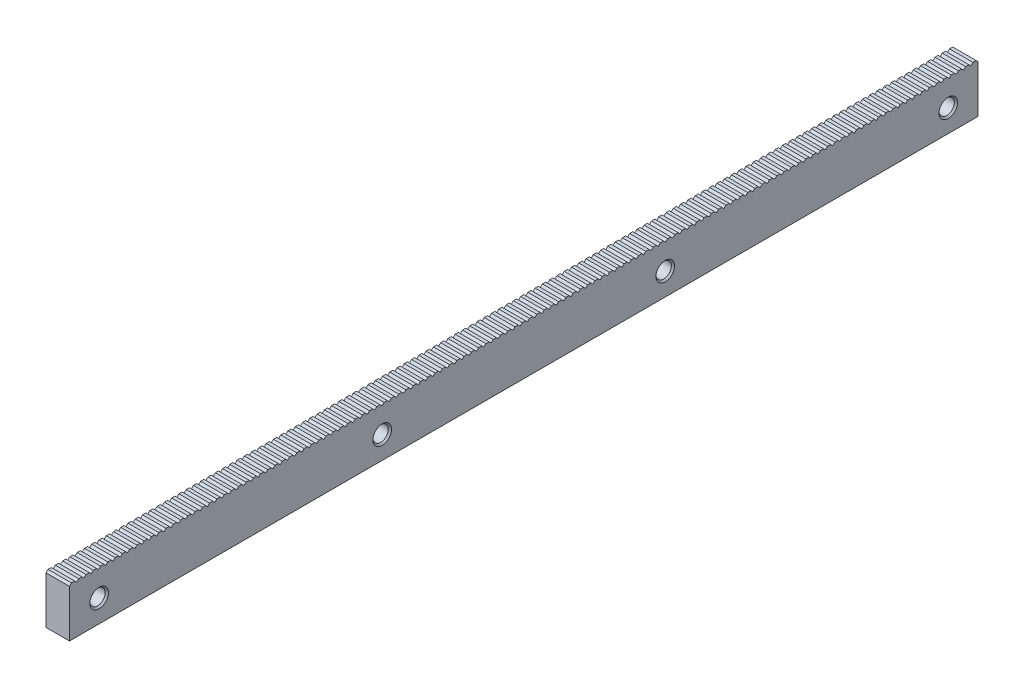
SolidWorks part; units mm, degrees
ref_plane "Front Plane" through (0, 0, 0) normal (0, 0, 1) x (1, 0, 0)
ref_plane "Top Plane" through (0, 0, 0) normal (0, 1, 0) x (1, 0, 0)
ref_plane "Right Plane" through (0, 0, 0) normal (1, 0, 0) x (0, 0, -1)
sketch "Sketch1" plane through (0, 0, 0) normal (1, 0, 0) x (0, 0, -1)
  line L1 (112.35, -6.1) -> (-112.35, -6.1)
  line L2 (112.35, -6.1) -> (112.35, 6.1)
  line L3 (112.35, 6.1) -> (-112.35, 6.1)
  line L4 (-112.35, -6.1) -> (-112.35, 6.1)
  line L5 (112.35, -6.1) -> (-112.35, 6.1) construction
  line L6 (112.35, 6.1) -> (-112.35, -6.1) construction
  point P0 (0, 0)
  dimension "D1" = 224.7
  dimension "D2" = 12.2
extrude "Boss-Extrude1" add sketch "Sketch1" along normal mid plane 5.8
sketch "Sketch2" plane through (0, 0, 0) normal (1, 0, 0) x (0, 0, -1)
  line L0 (-112.35, 5.6) -> (-112.85, 6.1)
  line L1 (-112.35, 6.1) -> (-112.35, -6.1) construction
  line L2 (-112.85, 6.1) -> (-111.85, 6.1)
  line L3 (112.35, 6.1) -> (-112.35, 6.1) construction
  line L4 (-111.85, 6.1) -> (-112.35, 5.6)
  line L5 (-112.35, -6.1) -> (112.35, -6.1) construction
  point P8 (-112.35, 5.6)
  dimension "D1" = 11.7
extrude "Cut-Extrude1" cut sketch "Sketch2" against normal mid plane 5.8
pattern_linear "LPattern1" count 126 spacing 1.798 along (0, -0.7071, -0.7071) of "Cut-Extrude1"
sketch "Sketch3" plane through (0, 0, 0) normal (1, 0, 0) x (0, 0, -1)
  line L0 (-112.35, -6.1) -> (112.35, -6.1) construction
  line L1 (-112.35, 5.6) -> (-112.35, -6.1) construction
  circle A0 centre (-105, -0.56) radius 1.9
  dimension "D3" = 3.8
  dimension "D1" = 5.54
  dimension "D2" = 7.35
extrude "Cut-Extrude2" cut sketch "Sketch3" against normal mid plane 5.8
chamfer "Chamfer1" distance 0.4 angle 45 2 edges at (-2.9, -0.56, 103.1) (2.9, -0.56, 103.1)
pattern_linear "LPattern2" count 4 spacing 70 along (0, 0, -1) of "Cut-Extrude2", "Chamfer1"
